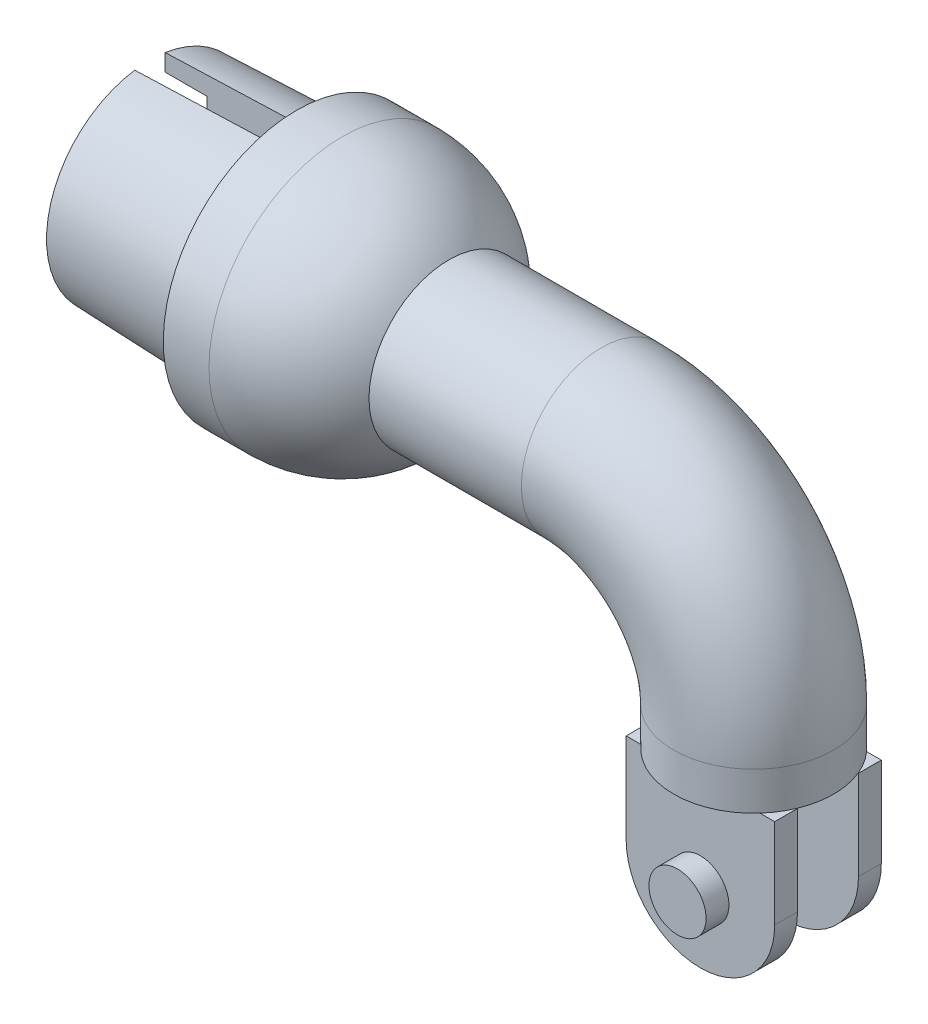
SolidWorks part; units mm, degrees
ref_plane "Front" through (0, 0, 0) normal (0, 0, 1) x (1, 0, 0)
ref_plane "Top" through (0, 0, 0) normal (0, 1, 0) x (1, 0, 0)
ref_plane "Right" through (0, 0, 0) normal (1, 0, 0) x (0, 0, -1)
ref_plane "Plane4" through (0, 6.35, 0) normal (0, 1, 0) x (-1, 0, 0)
sketch "Sketch1" plane through (0, 6.35, 0) normal (0, 1, 0) x (-1, 0, 0)
  circle A0 centre (0, 0) radius 5.334
  dimension "D1" = 10.668
sketch "Sketch2" plane through (0, 0, 0) normal (0, 0, 1) x (1, 0, 0)
  line L0 (0, 6.35) -> (0, 8.89)
  line L1 (-10.16, 19.05) -> (-25.4, 19.05)
  line L2 (50, 6.35) -> (-50, 6.35) construction
  arc A0 (-10.16, 19.05) -> (0, 8.89) centre (-10.16, 8.89) cw
  point P8 (0, 19.05)
  dimension "D3" = 10.16
  dimension "D1" = 12.7
  dimension "D2" = 25.4
sweep "Base-Sweep" add profiles "Sketch1" path "Sketch2"
sketch "Sketch3" plane through (0, 0, 0) normal (0, 0, 1) x (1, 0, 0)
  line L0 (-36.1722, 19.05) -> (-64.353, 19.05) construction
  line L1 (-10.16, 19.05) -> (-25.4, 19.05) construction
  line L2 (-27.432, 27.94) -> (-30.48, 27.94)
  line L3 (-30.48, 27.94) -> (-30.48, 19.05)
  line L4 (-30.48, 19.05) -> (-18.542, 19.05)
  line L5 (0, -50) -> (0, 50) construction
  line L6 (-10.16, 24.384) -> (-25.4, 24.384) construction
  line L7 (-10.16, 24.384) -> (-25.4, 24.384) construction
  arc A0 (-18.542, 19.05) -> (-27.432, 27.94) centre (-27.432, 19.05) ccw
  point P13 (-20.32, 24.384)
  dimension "D3" = 8.89
  dimension "D1" = 17.78
  dimension "D2" = 30.48
  dimension "D4" = 3.048
  dimension "D5" = 20.32
revolve "Boss-Revolve1" add sketch "Sketch3" angle 360 about L0
sketch "Sketch4" plane through (-30.48, 0, 0) normal (-1, 0, 0) x (0, 0, 1)
  circle A0 centre (0, 19.05) radius 7.239
  dimension "D1" = 14.478
extrude "Boss-Extrude1" add sketch "Sketch4" along normal blind 9.779 draft 2
shell "Shell1" thickness 2.032
ref_plane "Plane5" through (0, 2.7898, 6.7352) normal (0, 0.3827, 0.9239) x (1, 0, 0)
sketch "Sketch6" plane through (0, 2.7898, 6.7352) normal (0, 0.3827, 0.9239) x (1, 0, 0)
  line L0 (-36.83, 24.6172) -> (-30.48, 24.8389)
  line L1 (-30.48, 24.8389) -> (-40.259, 24.4974) construction
  dimension "D1" = 6.35
sketch "Sketch7" plane through (-30.48, 0, 0) normal (-1, 0, 0) x (0, 0, 1)
  line L0 (12.0969, -10.1545) -> (1.3735, 15.7341) construction
  line L1 (-2.6244, 25.386) -> (-2.8765, 25.9944) construction
  circle A0 centre (-2.6244, 25.386) radius 0.508
  circle A1 centre (0, 19.05) radius 7.239 construction
  circle A2 centre (0, 19.05) radius 7.239 construction
  dimension "D1" = 1.016
  dimension "D2" = 0.127
sweep "Boss-Sweep1" add profiles "Sketch7" path "Sketch6"
pattern_circular "CirPattern1" count 8 every 45 about axis through (-36.1722, 19.05, 0) along (-1, 0, 0)
sketch "Sketch8" plane through (-40.259, 0, 0) normal (-1, 0, 0) x (0, 0, 1)
  circle A0 centre (0, 19.05) radius 5.7785
  dimension "D1" = 11.557
extrude "Cut-Extrude1" cut sketch "Sketch8" against normal blind 2.794
sketch "Sketch9" plane through (0, 0, 0) normal (0, 1, 0) x (1, 0, 0)
  line L1 (-31.115, 1.016) -> (-31.115, -1.016)
  line L2 (-40.259, 1.016) -> (-31.115, 1.016)
  line L3 (-40.259, 1.016) -> (-40.259, -1.016)
  line L4 (-31.115, -1.016) -> (-40.259, -1.016)
  line L5 (-50, 0) -> (50, 0) construction
  line L6 (-40.259, 6.8975) -> (-40.259, -6.8975) construction
  line L7 (-30.48, 8.89) -> (-30.48, -8.89) construction
  point P5 (-40.259, 0)
  dimension "D1" = 2.032
  dimension "D2" = 0.635
extrude "Cut-Extrude2" cut sketch "Sketch9" along normal through all
ref_plane "Plane6" through (0, 0, -3.556) normal (0, 0, 1) x (1, 0, 0)
sketch "Sketch10" plane through (0, 12.319, -3.556) normal (0, 0, -1) x (1, 0, 0)
  line L0 (-4.953, 5.969) -> (4.953, 5.969)
  line L1 (-4.953, 5.969) -> (-4.953, 11.938)
  line L3 (4.953, 11.938) -> (4.953, 5.969)
  line L4 (0, -37.681) -> (0, 62.319) construction
  line L5 (5.334, 5.969) -> (-5.334, 5.969) construction
  arc A0 (-4.953, 11.938) -> (4.953, 11.938) centre (0, 11.938) cw
  dimension "D1" = 9.906
  dimension "D2" = 10.922
extrude "Boss-Extrude2" add sketch "Sketch10" against normal blind 1.524
sketch "Sketch11" plane through (0, 0, -3.556) normal (0, 0, -1) x (-1, 0, 0)
  circle A0 centre (0, 0) radius 1.905
  dimension "D1" = 3.81
extrude "Boss-Extrude3" add sketch "Sketch11" along normal blind 1.524
mirror "Mirror1" about plane through (0, 0, 0) normal (0, 0, 1)
